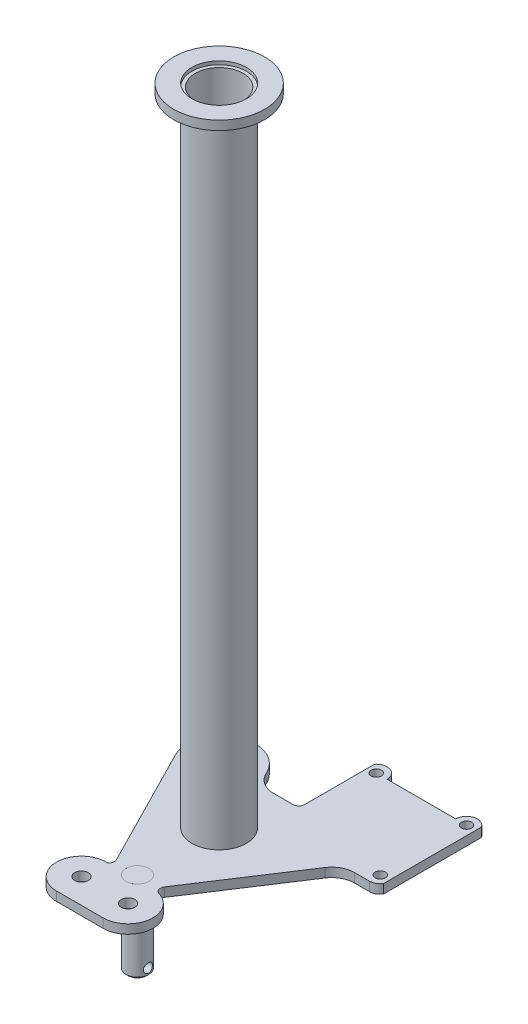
SolidWorks part; units mm, degrees
ref_plane "Plan de face" through (0, 0, 0) normal (0, 0, 1) x (1, 0, 0)
ref_plane "Plan de dessus" through (0, 0, 0) normal (0, 1, 0) x (1, 0, 0)
ref_plane "Plan de droite" through (0, 0, 0) normal (1, 0, 0) x (0, 0, -1)
sketch "Esquisse1" plane through (0, 0, 0) normal (0, 1, 0) x (1, 0, 0)
  line L0 (-20.7953, -69.7294) -> (-74.8281, 36.2762)
  line L1 (-2.4, 50.1857) -> (15, 50.1857)
  line L2 (20, 55.1857) -> (20, 116.731)
  line L3 (37, 110.9) -> (97.5, 110.9)
  line L4 (115, 116.0235) -> (115, 29.7765)
  line L5 (107, 25.4) -> (93.8031, 25.4)
  line L6 (77.0658, 16.3482) -> (21.0657, -69.2629)
  line L7 (17.6218, -119.9) -> (-23.3782, -119.9)
  line L8 (-25.25, -72) -> (25.25, -72) construction
  arc A0 (-74.8281, 36.2762) -> (-20.68, 62.0714) centre (-48.1, 49.9) cw
  arc A2 (15, 50.1857) -> (20, 55.1857) centre (15, 55.1857) ccw
  arc A3 (20, 116.731) -> (37, 110.9) centre (27.5, 110.9) cw
  arc A4 (97.5, 110.9) -> (115, 116.0235) centre (107, 110.9) cw
  arc A5 (115, 29.7765) -> (107, 25.4) centre (107, 34.9) cw
  arc A6 (93.8031, 25.4) -> (77.0658, 16.3482) centre (93.8031, 5.4) ccw
  arc A7 (21.0657, -69.2629) -> (23.8374, -76.7963) centre (25.25, -72) ccw
  arc A8 (23.8374, -76.7963) -> (17.6218, -119.9) centre (17.6218, -97.9) cw
  arc A9 (-23.3782, -119.9) -> (-22.1634, -75.9336) centre (-23.3782, -97.9) cw
  arc A10 (-22.1634, -75.9336) -> (-20.7953, -69.7294) centre (-25.25, -72) ccw
  circle A11 centre (0, 0) radius 24
  circle A12 centre (-48.1, 49.9) radius 19
  circle A13 centre (0, -72) radius 10
  circle A14 centre (-23.3782, -97.9) radius 6
  circle A15 centre (17.6218, -97.9) radius 6
  circle A16 centre (107, 110.9) radius 4.5
  circle A17 centre (107, 34.9) radius 4.5
  circle A18 centre (27.5, 110.9) radius 4.5
  arc A19 (-2.4, 50.1857) -> (-20.68, 62.0714) centre (-2.4, 70.1857) cw
  dimension "D1" = 48
  dimension "D2" = 38
  dimension "D3" = 30
  dimension "D4" = 9
  dimension "D5" = 9.5
  dimension "D6" = 20
  dimension "D7" = 5
  dimension "D8" = 22
  dimension "D9" = 12
  dimension "D10" = 20
  dimension "D11" = 5
  dimension "D12" = 20
  dimension "D13" = 41
  dimension "D14" = 22
  dimension "D15" = 48.1
  dimension "D16" = 49.9
  dimension "D17" = 20
  dimension "D18" = 95
  dimension "D19" = 85.5
  dimension "D20" = 25.4
  dimension "D21" = 8
  dimension "D22" = 7.5
  dimension "D23" = 72
  dimension "D24" = 25.9
  dimension "D25" = 50.5
  dimension "D26" = 102.3
  dimension "D27" = 17.4
extrude "Extrusion1" add sketch "Esquisse1" along normal blind 8
sketch "Esquisse2" plane through (0, 0, 0) normal (1, 0, 0) x (0, 0, -1)
  line L0 (0, -5) -> (0, 573)
  line L1 (-24, 0) -> (24, 0) construction
  dimension "D1" = 5
  dimension "D2" = 578
other "Elément mécano-soudé1"
ref_plane "Plan1" through (0, -5, 0) normal (0, 1, 0) x (-1, 0, 0)
sketch "Esquisse11" plane through (0, -5, 0) normal (0, 1, 0) x (-1, 0, 0)
  line L0 (-24, 0) -> (24, 0) construction
  line L1 (0, 24) -> (0, -24) construction
  circle A0 centre (0, 0) radius 24
  circle A1 centre (0, 0) radius 21
  point P8 (0, 0)
  dimension "D1" = 48
  dimension "D2" = 42
sketch "Esquisse12" plane through (0, 0, 0) normal (1, 0, 0) x (0, 0, -1)
  line L0 (-72, 8) -> (-72, -65)
  line L1 (-62, 8) -> (-82, 8) construction
  dimension "D1" = 73
other "Elément mécano-soudé2"
ref_plane "Plan2" through (0, 8, 72) normal (0, -1, 0) x (1, 0, 0)
sketch "Esquisse13" plane through (0, 8, 72) normal (0, -1, 0) x (1, 0, 0)
  line L0 (-10, 0) -> (10, 0) construction
  line L1 (0, 10) -> (0, -10) construction
  circle A0 centre (0, 0) radius 10
  point P7 (0, 0)
  dimension "D1" = 20
chamfer "Chanfrein1" distance 2 angle 45 1 edges at (0, -65, 62)
sketch "Esquisse14" plane through (0, 0, 0) normal (1, 0, 0) x (0, 0, -1)
  line L0 (-72, 8) -> (-72, -65) construction
  line L2 (-80, -65) -> (-64, -65) construction
  circle A0 centre (-72, -58) radius 4
  dimension "D1" = 8
  dimension "D2" = 7
extrude "Enlèv. mat.-Extru.1" cut sketch "Esquisse14" against normal through all and the other way through all
inserted part "laser rondelle haut guide guidon"
move or copy body "Corps-Déplacer/Copier2" placed by mates yes
other "Distance1" parameters "D1"=560
other "<laser rondelle haut guide guidon>-<Extrusion1>"
